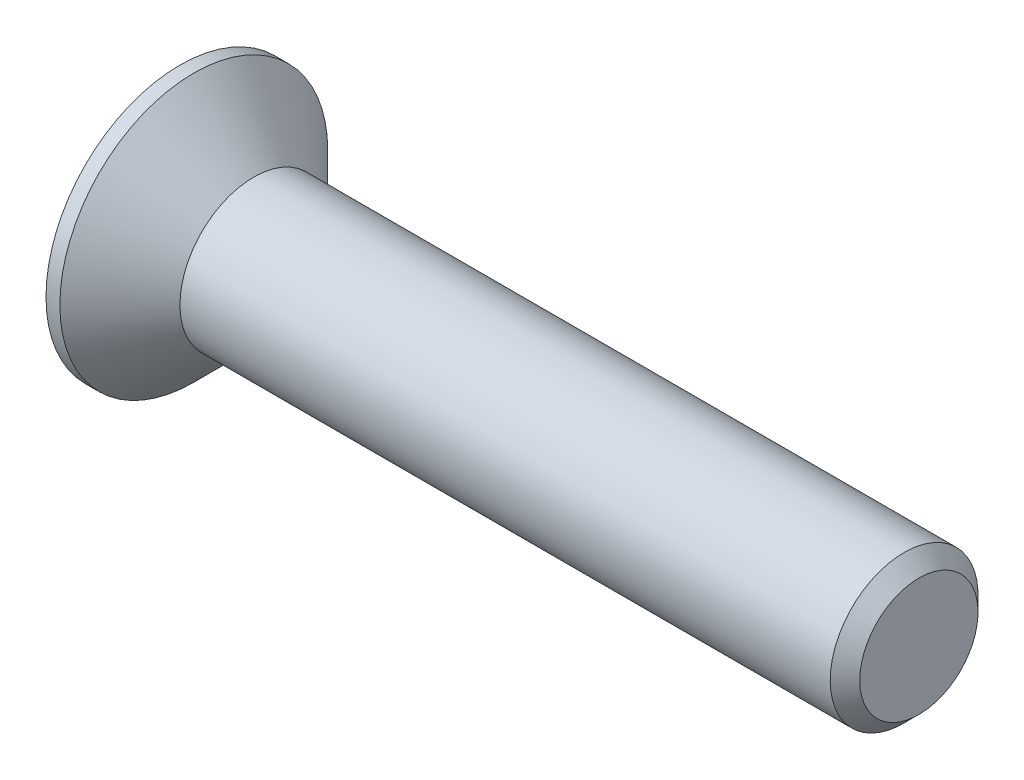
SolidWorks part; units mm, degrees
ref_plane "Front Plane" through (0, 0, 0) normal (0, 0, 1) x (1, 0, 0)
ref_plane "Top Plane" through (0, 0, 0) normal (0, 1, 0) x (1, 0, 0)
ref_plane "Right Plane" through (0, 0, 0) normal (1, 0, 0) x (0, 0, -1)
sketch "Sketch1" plane through (0, 0, 0) normal (0, 0, 1) x (1, 0, 0)
  line L1 (-4, 7.25) -> (-4, 0)
  line L2 (-4, 0) -> (36, 0)
  line L3 (36, 0) -> (36, 4)
  line L4 (36, 4) -> (0, 4)
  line L5 (-4, 7.25) -> (-3.25, 7.25)
  line L6 (-3.25, 7.25) -> (0, 4)
  dimension "D1" = 4
  dimension "D2" = 45
  dimension "D3" = 4
  dimension "D4" = 40
  dimension "D5" = 7.25
revolve "Revolve1" add sketch "Sketch1" angle 360 about L2
chamfer "Chamfer1" distance 0.8 angle 45 1 edges at (36, 0, 4)
sketch "Sketch2" plane through (-4, 0, 0) normal (-1, 0, 0) x (0, 0, 1)
  line L0 (-1.09, 4.35) -> (1.09, 4.35)
  line L1 (1.09, 4.35) -> (1.09, 1.09)
  line L2 (1.09, 1.09) -> (4.35, 1.09)
  line L3 (4.35, 1.09) -> (4.35, -1.09)
  line L4 (4.35, -1.09) -> (1.09, -1.09)
  line L5 (1.09, -1.09) -> (1.09, -4.35)
  line L6 (1.09, -4.35) -> (-1.09, -4.35)
  line L7 (-1.09, -4.35) -> (-1.09, -1.09)
  line L8 (-1.09, -1.09) -> (-4.35, -1.09)
  line L9 (-4.35, -1.09) -> (-4.35, 1.09)
  line L10 (-4.35, 1.09) -> (-1.09, 1.09)
  line L11 (-1.09, 1.09) -> (-1.09, 4.35)
  point P2 (0, 4.35)
  point P14 (0, -4.35)
  point P15 (4.35, 0)
  point P16 (-4.35, 0)
  dimension "D1" = 8.7
  dimension "D2" = 2.18
extrude "Cut-Extrude1" cut sketch "Sketch2" against normal blind 3.45
